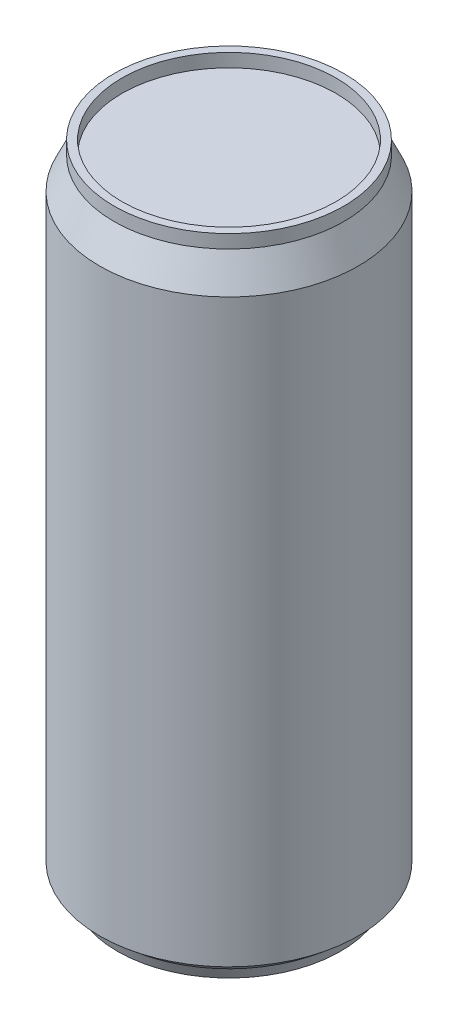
SolidWorks part; units mm, degrees
ref_plane "Plan de face" through (0, 0, 0) normal (0, 0, 1) x (1, 0, 0)
ref_plane "Plan de dessus" through (0, 0, 0) normal (0, 1, 0) x (1, 0, 0)
ref_plane "Plan de droite" through (0, 0, 0) normal (1, 0, 0) x (0, 0, -1)
sketch "Esquisse1" plane through (0, 0, 0) normal (0, 0, 1) x (1, 0, 0)
  line L0 (0, 0) -> (0, 145) construction
  line L1 (0, 142) -> (-24, 142)
  line L2 (-24, 142) -> (-24, 145)
  line L3 (-24, 145) -> (-25.75, 145)
  line L4 (-25.75, 145) -> (-25.75, 142)
  line L5 (-25.75, 142) -> (-29, 135)
  line L6 (-29, 135) -> (-29, 5)
  line L7 (-29, 5) -> (-26, 2.5)
  line L8 (-26, 2.5) -> (-25, 0)
  line L9 (-25, 0) -> (-22, 0)
  line L10 (-22, 0) -> (-22, 2.5)
  line L11 (0, 0) -> (0, -26.0167) construction
  line L12 (-26, 2.5) -> (-22, 2.5) construction
  line L13 (0, 142) -> (0, 10)
  arc A0 (0, 10) -> (-22, 2.5) centre (0, -26.0167) ccw
  dimension "D1" = 145
  dimension "D2" = 24
  dimension "D3" = 25.75
  dimension "D4" = 29
  dimension "D5" = 3
  dimension "D6" = 3
  dimension "D7" = 10
  dimension "D8" = 26
  dimension "D9" = 5
  dimension "D10" = 2.5
  dimension "D11" = 25
  dimension "D12" = 22
  dimension "D13" = 10
revolve "Révolution1" add sketch "Esquisse1" angle 360 about L13
